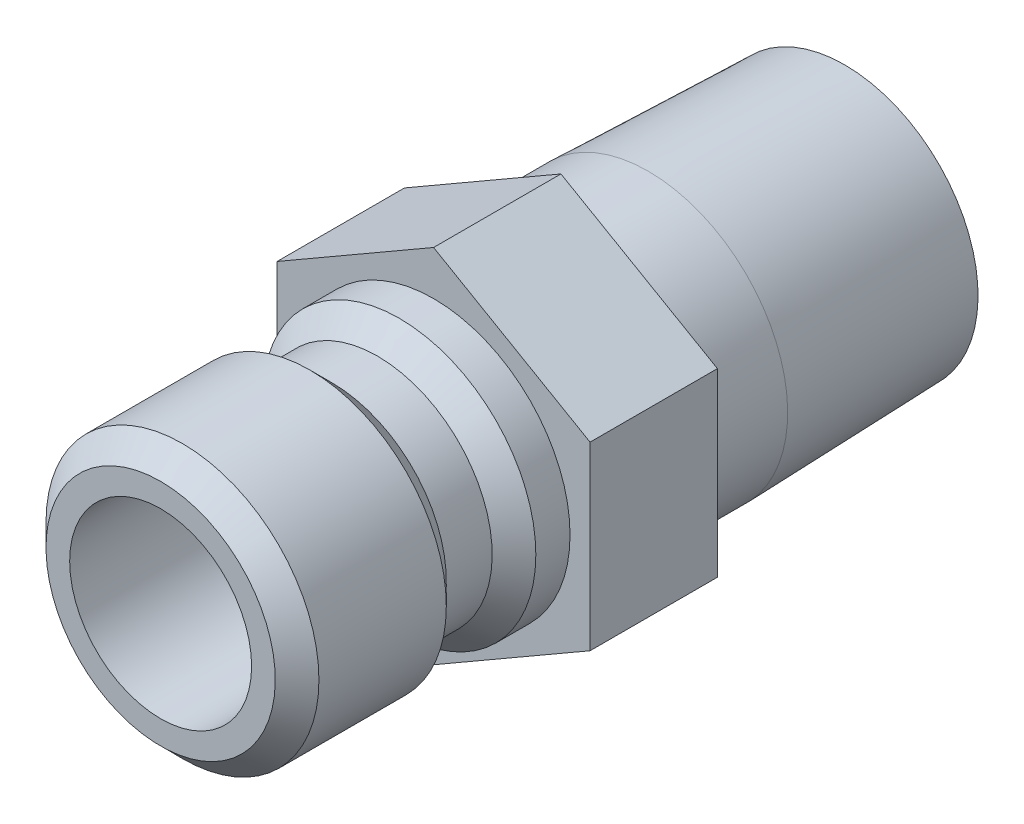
SolidWorks part; units mm, degrees
ref_plane "Front Plane" through (0, 0, 0) normal (0, 0, 1) x (1, 0, 0)
ref_plane "Top Plane" through (0, 0, 0) normal (0, 1, 0) x (1, 0, 0)
ref_plane "Right Plane" through (0, 0, 0) normal (1, 0, 0) x (0, 0, -1)
sketch "Sketch1" plane through (0, 0, 0) normal (1, 0, 0) x (0, 0, -1)
  line L0 (0, 0) -> (-12.7, 0) construction
  line L1 (-9.525, 3.175) -> (-9.525, 4.0005)
  line L2 (-3.556, 4.0005) -> (-3.556, 0) construction
  line L3 (-8.763, 4.7625) -> (-4.318, 4.7625)
  line L4 (0, 4.8641) -> (0, 0) construction
  line L5 (-3.556, 4.0005) -> (-1.9558, 4.0005)
  line L6 (-1.1938, 4.7625) -> (0, 4.7625)
  line L7 (0, 4.7625) -> (0, 4.8641)
  line L8 (-3.556, 4.0005) -> (-4.318, 4.7625)
  line L9 (-1.9558, 4.0005) -> (-1.1938, 4.7625)
  line L10 (-9.525, 4.0005) -> (-8.763, 4.7625)
  line L11 (-9.525, 3.175) -> (0.127, 3.175)
  line L12 (0, 4.8641) -> (7.493, 4.8641)
  line L13 (7.493, 4.8641) -> (14.351, 4.6498)
  line L14 (14.351, 4.6498) -> (14.351, 2.9464)
  line L15 (0, 0) -> (4.445, 0) construction
  line L16 (0.127, 3.175) -> (0.127, 2.9464)
  line L17 (0.127, 2.9464) -> (14.351, 2.9464)
  dimension "D1" = 9.525
  dimension "D2" = 1.6002
  dimension "D3" = 0.762
  dimension "D4" = 45
  dimension "D5" = 5.969
  dimension "D6" = 45
  dimension "D7" = 1.79
  dimension "D8" = 6.858
  dimension "D9" = 23.876
  dimension "D10" = 3.175
  dimension "D11" = 4.445
  dimension "D12" = 6.35
  dimension "D13" = 9.652
  dimension "D14" = 9.525
  dimension "D15" = 9.7282
  dimension "D16" = 5.8928
revolve "Revolve1" add sketch "Sketch1" angle 360 about L0
sketch "Sketch2" plane through (0, 0, 0) normal (0, 0, 1) x (1, 0, 0)
  line L1 (-5.461, 3.1529) -> (-5.461, -3.1529)
  line L2 (-5.461, -3.1529) -> (0, -6.3058)
  line L3 (0, -6.3058) -> (5.461, -3.1529)
  line L4 (5.461, -3.1529) -> (5.461, 3.1529)
  line L5 (5.461, 3.1529) -> (0, 6.3058)
  line L6 (0, 6.3058) -> (-5.461, 3.1529)
  circle A0 centre (0, 0) radius 5.461 construction
  circle A1 centre (0, 0) radius 3.175 construction
  circle A2 centre (0, 0) radius 3.175
  dimension "D1" = 10.922
extrude "Boss-Extrude1" add sketch "Sketch2" against normal up to vertex (4.445 mm away)
